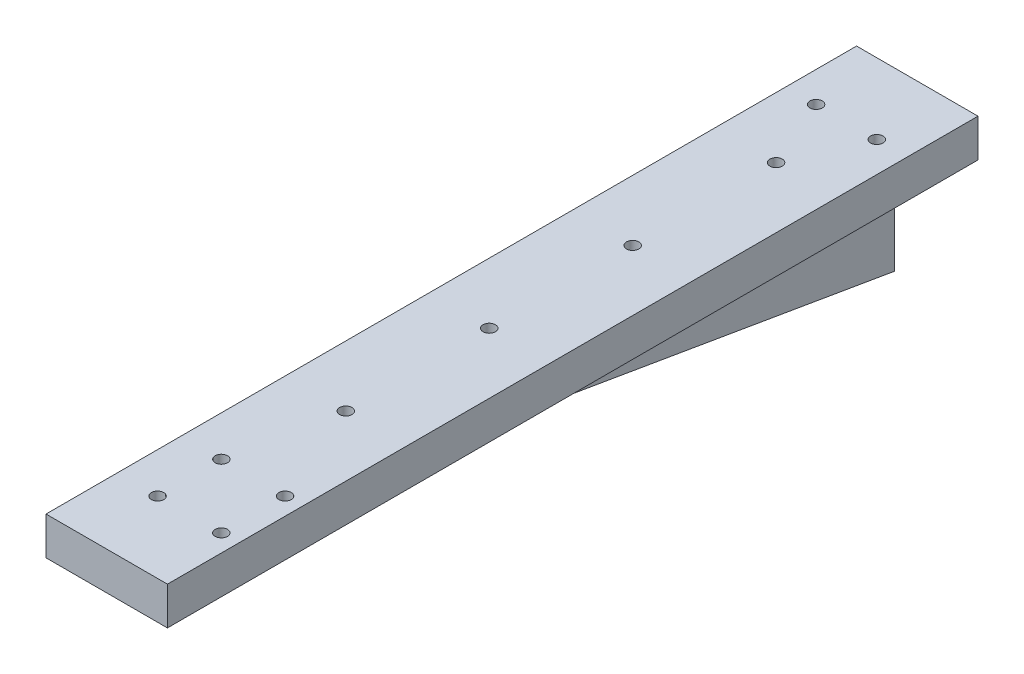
SolidWorks part; units mm, degrees
ref_plane "Front" through (0, 0, 0) normal (0, 0, 1) x (1, 0, 0)
ref_plane "Top" through (0, 0, 0) normal (0, 1, 0) x (1, 0, 0)
ref_plane "Right" through (0, 0, 0) normal (1, 0, 0) x (0, 0, -1)
sketch "Sketch1" plane through (0, 0, 0) normal (0, 0, 1) x (1, 0, 0)
  line L1 (-12.7, 3.9624) -> (12.7, 3.9624)
  line L2 (-12.7, 3.9624) -> (-12.7, -3.9751)
  line L3 (-12.7, -3.9751) -> (12.7, -3.9751)
  line L4 (12.7, 3.9624) -> (12.7, -3.9751)
  point P4 (0, -3.9751)
  dimension "D1" = 7.9375
  dimension "D2" = 25.4
  dimension "D3" = 3.9624
extrude "Extrude1" add sketch "Sketch1" along normal blind 169.545
sketch "Sketch2" plane through (0, 0, 0) normal (0, 0, -1) x (-1, 0, 0)
  line L0 (-12.7, 3.9624) -> (12.7, 3.9624) construction
  line L1 (-9.0043, 3.9624) -> (9.0043, 3.9624)
  line L2 (-9.0043, 3.9624) -> (-9.0043, 2.6924)
  line L3 (-9.0043, 2.6924) -> (9.0043, 2.6924)
  line L4 (9.0043, 3.9624) -> (9.0043, 2.6924)
  point P4 (0, 2.6924)
  dimension "D1" = 1.27
  dimension "D2" = 18.0086
extrude "Cut-Extrude1" [suppressed] cut sketch "Sketch2" against normal through all
sketch "Sketch3" plane through (-12.7, 0, 0) normal (-1, 0, 0) x (0, 0, 1)
  line L0 (0, -3.9751) -> (0, -32.8676)
  line L1 (0, -32.8676) -> (169.545, -3.9751)
  line L2 (169.545, -3.9751) -> (0, -3.9751)
  line L3 (169.545, 3.9624) -> (0, 3.9624) construction
  dimension "D1" = 36.83
extrude "Extrude2" add sketch "Sketch3" against normal blind 7.9375
fillet "Fillet1" radius 6.35 1 edges
hole_wizard "#8-32 Tapped Hole1" positions "Sketch5" profile "Sketch4" tap size "#8-32" standard "Ansi Inch"
sketch "Sketch5" plane through (0, 0, 0) normal (0, 0, -1) x (-1, 0, 0)
  line L1 (-12.7, -3.9751) -> (-12.7, 3.9624) construction
  line L2 (4.7625, -32.8676) -> (12.7, -32.8676) construction
  line L3 (12.7, 3.9624) -> (12.7, -32.8676) construction
  point P0 (8.7376, 0)
  point P1 (8.7376, -25.2476)
  point P2 (-8.7376, 0)
  dimension "D1" = 3.9624
  dimension "D2" = 7.62
  dimension "D3" = 3.9624
sketch "Sketch4" plane through (-8.7376, 0, 0) normal (1, 0, 0) x (0, 1, 0)
  line L0 (0, 0) -> (0, 10.7086)
  line L1 (0, 10.7086) -> (1.7272, 10.7086)
  line L2 (1.7272, 10.7086) -> (1.7272, 0)
  line L5 (1.7272, 0) -> (0, 0)
  line L10 (0, 10.7086) -> (-1.7272, 10.7086) construction
  line L11 (0, -6.35) -> (0, 107.95) construction
  dimension "Tap Drill Dia." = 3.4544
  dimension "Tap Drill Depth" = 10.7086
  dimension "Drill Angle" = 180
hole_wizard "#5-40 Tapped Hole1" positions "Sketch7" profile "Sketch6" tap size "#5-40" standard "Ansi Inch"
sketch "Sketch7" plane through (-12.7, 0, 0) normal (-1, 0, 0) x (0, 0, 1)
  point P0 (5.3975, -4.4958)
  dimension "D1" = 5.3975
  dimension "D2" = 4.4958
sketch "Sketch6" plane through (-12.7, -4.4958, 5.3975) normal (0, 1, 0) x (0, 0, 1)
  line L0 (0, 0) -> (0, 11.5695)
  line L1 (0, 11.5695) -> (1.289, 10.795)
  line L2 (1.289, 10.795) -> (1.289, 0)
  line L5 (1.289, 0) -> (0, 0)
  line L10 (0, 11.5695) -> (-1.2891, 10.795) construction
  line L11 (0, -6.35) -> (0, 107.95) construction
  dimension "Tap Drill Dia." = 2.5781
  dimension "Tap Drill Depth" = 10.795
  dimension "Drill Angle" = 118
hole_wizard "#5-40 Tapped Hole2" positions "Sketch9" profile "Sketch8" tap size "#5-40" standard "Ansi Inch"
sketch "Sketch9" plane through (0, 3.9624, 0) normal (0, 1, 0) x (-1, 0, 0)
  circle A0 centre (-9.0487, 154.6225) radius 1.6319 construction
  circle A1 centre (4.2863, 154.6225) radius 1.6319 construction
  circle A2 centre (-9.0487, 141.2875) radius 1.6319 construction
  circle A3 centre (4.2863, 141.2875) radius 1.6319 construction
  point P0 (-9.0487, 154.6225)
  point P1 (4.2863, 154.6225)
  point P2 (4.2863, 141.2875)
  point P3 (-9.0487, 141.2875)
sketch "Sketch8" plane through (9.0487, 3.9624, 154.6225) normal (1, 0, 0) x (0, 0, 1)
  line L0 (0, 0) -> (0, 36.83)
  line L1 (0, 36.83) -> (1.289, 36.83)
  line L2 (1.289, 36.83) -> (1.289, 0)
  line L5 (1.289, 0) -> (0, 0)
  line L11 (0, -6.35) -> (0, 107.95) construction
  dimension "Thru Tap Drill Dia." = 2.5781
  dimension "Thru Tap Drill Depth" = 36.83
hole_wizard "#5-40 Tapped Hole3" positions "Sketch11" profile "Sketch10" tap size "#5-40" standard "Ansi Inch"
sketch "Sketch11" plane through (0, 3.9624, 0) normal (0, 1, 0) x (-1, 0, 0)
  circle A0 centre (0, 29.5326) radius 1.75 construction
  circle A1 centre (0, 59.5326) radius 1.75 construction
  circle A2 centre (0, 89.5326) radius 1.75 construction
  circle A3 centre (0, 119.5326) radius 1.75 construction
  point P0 (0, 29.5326)
  point P1 (0, 59.5326)
  point P2 (0, 89.5326)
  point P3 (0, 119.5326)
sketch "Sketch10" plane through (0, 3.9624, 29.5326) normal (1, 0, 0) x (0, 0, 1)
  line L0 (0, 0) -> (0, 36.83)
  line L1 (0, 36.83) -> (1.289, 36.83)
  line L2 (1.289, 36.83) -> (1.289, 0)
  line L5 (1.289, 0) -> (0, 0)
  line L11 (0, -6.35) -> (0, 107.95) construction
  dimension "Thru Tap Drill Dia." = 2.5781
  dimension "Thru Tap Drill Depth" = 36.83
hole_wizard "3/16 (0.187500) Diameter Hole1" positions "Sketch15" profile "Sketch14" hole size "3/16" standard "Ansi Inch"
sketch "Sketch15" plane through (0, 0, 0) normal (0, 0, -1) x (-1, 0, 0)
  line L0 (-8.7376, 0) -> (8.7376, 0) construction
  line L1 (8.7376, 0) -> (8.7376, -25.2476) construction
  circle A0 centre (-8.7376, 0) radius 1.7272 construction
  circle A1 centre (8.7376, -25.2476) radius 1.7272 construction
  circle A2 centre (8.7376, 0) radius 1.7272 construction
  point P0 (8.7376, -12.6238)
  point P1 (0, 0)
sketch "Sketch14" plane through (-8.7376, -12.6238, 0) normal (1, 0, 0) x (0, 1, 0)
  line L0 (0, 0) -> (0, 7.7884)
  line L1 (0, 7.7884) -> (2.3939, 6.35)
  line L2 (2.3939, 6.35) -> (2.3939, 0)
  line L5 (2.3939, 0) -> (0, 0)
  line L10 (0, 7.7884) -> (-2.394, 6.35) construction
  line L11 (0, -6.35) -> (0, 107.95) construction
  dimension "Hole Dia." = 4.7879
  dimension "Hole Depth" = 6.35
  dimension "Drill Angle" = 118
hole_wizard "#5-40 Tapped Hole4" positions "Sketch17" profile "Sketch16" tap size "#5-40" standard "Ansi Inch"
sketch "Sketch17" plane through (0, 3.9624, 0) normal (0, 1, 0) x (-1, 0, 0)
  line L0 (6.35, 15.4432) -> (6.35, 14.1732) construction
  line L1 (-6.35, 15.4432) -> (-6.35, 14.1732) construction
  arc A2 (-4.6228, 15.4432) -> (-8.0772, 15.4432) centre (-6.35, 15.4432) ccw construction
  arc A3 (-8.0772, 14.1732) -> (-4.6228, 14.1732) centre (-6.35, 14.1732) ccw construction
  arc A4 (8.0772, 15.4432) -> (4.6228, 15.4432) centre (6.35, 15.4432) ccw construction
  arc A5 (4.6228, 14.1732) -> (8.0772, 14.1732) centre (6.35, 14.1732) ccw construction
  point P0 (6.35, 14.8082)
  point P1 (-6.35, 14.8082)
sketch "Sketch16" plane through (-6.35, 3.9624, 14.8082) normal (1, 0, 0) x (0, 0, 1)
  line L0 (0, 0) -> (0, 10.795)
  line L1 (0, 10.795) -> (1.289, 10.795)
  line L2 (1.289, 10.795) -> (1.289, 0)
  line L5 (1.289, 0) -> (0, 0)
  line L10 (0, 10.795) -> (-1.2891, 10.795) construction
  line L11 (0, -6.35) -> (0, 107.95) construction
  dimension "Tap Drill Dia." = 2.5781
  dimension "Tap Drill Depth" = 10.795
  dimension "Drill Angle" = 180
hole_wizard "3/32 (0.09375) Diameter Hole1" positions "Sketch19" profile "Sketch18" hole size "3/32" standard "Ansi Inch"
sketch "Sketch19" plane through (-12.7, 0, 0) normal (-1, 0, 0) x (0, 0, 1)
  point P0 (5.3975, -16.4338)
  dimension "D1" = 5.3975
  dimension "D2" = 16.4338
sketch "Sketch18" plane through (-12.7, -16.4338, 5.3975) normal (0, 1, 0) x (0, 0, 1)
  line L0 (0, 0) -> (0, 3.81)
  line L1 (0, 3.81) -> (1.1906, 3.81)
  line L2 (1.1906, 3.81) -> (1.1906, 0)
  line L5 (1.1906, 0) -> (0, 0)
  line L10 (0, 3.81) -> (-1.1906, 3.81) construction
  line L11 (0, -6.35) -> (0, 107.95) construction
  dimension "Hole Dia." = 2.3812
  dimension "Hole Depth" = 3.81
  dimension "Drill Angle" = 180
ref_plane "Plane1" [suppressed] through (0, 0, 9.525) normal (0, 0, -1) x (-1, 0, 0)
sketch "Sketch20" [suppressed] plane through (0, 0, 9.525) normal (0, 0, -1) x (-1, 0, 0)
  line L1 (12.7, 3.9624) -> (-14.6815, 3.9624)
  line L2 (12.7, 3.9624) -> (12.7, -34.3505)
  line L3 (12.7, -34.3505) -> (-14.6815, -34.3505)
  line L4 (-14.6815, 3.9624) -> (-14.6815, -34.3505)
extrude "Cut-Extrude2" [suppressed] cut sketch "Sketch20" against normal through all
sketch "Sketch22" [suppressed] plane through (0, 3.9624, 0) normal (0, 1, 0) x (-1, 0, 0)
  line L0 (12.7, 9.525) -> (12.7, 0) construction
  line L1 (-12.7, 0) -> (12.7, 0)
  line L2 (-12.7, 0) -> (-12.7, 4.2565)
  line L3 (-12.7, 4.2565) -> (12.7, 4.2565)
  line L4 (12.7, 0) -> (12.7, 4.2565)
extrude "Extrude3" [suppressed] add sketch "Sketch22" along normal blind 45.72
sketch "Sketch23" plane through (0, 0, 169.545) normal (0, 0, 1) x (1, 0, 0)
  line L1 (-12.7, 3.9624) -> (19.8862, 3.9624)
  line L2 (-12.7, 3.9624) -> (-12.7, -38.3366)
  line L3 (-12.7, -38.3366) -> (19.8862, -38.3366)
  line L4 (19.8862, 3.9624) -> (19.8862, -38.3366)
extrude "Cut-Extrude4" [suppressed] cut sketch "Sketch23" against normal up to surface (23.3618 mm away)
